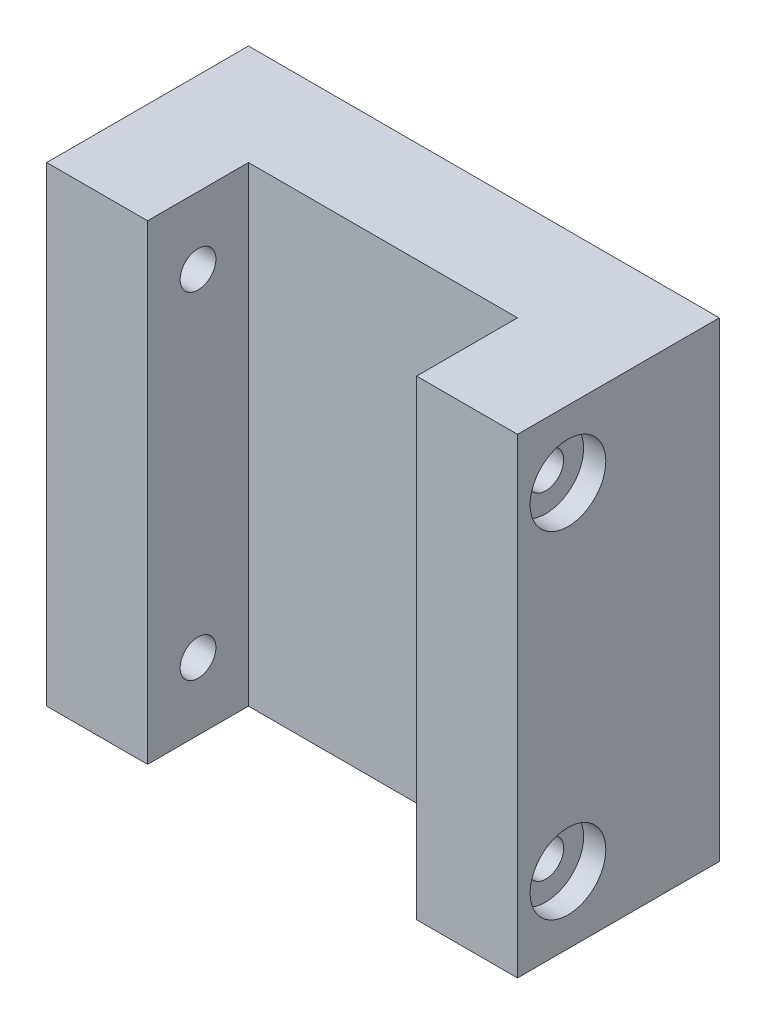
SolidWorks part; units mm, degrees
ref_plane "Front" through (0, 0, 0) normal (0, 0, 1) x (1, 0, 0)
ref_plane "Top" through (0, 0, 0) normal (0, 1, 0) x (1, 0, 0)
ref_plane "Right" through (0, 0, 0) normal (1, 0, 0) x (0, 0, -1)
sketch "Sketch1" plane through (0, 0, 0) normal (0, 0, 1) x (1, 0, 0)
  line L0 (-44.45, -44.45) -> (44.45, 44.45) construction
  line L1 (-44.45, -44.45) -> (44.45, -44.45)
  line L2 (-44.45, -44.45) -> (-44.45, 44.45)
  line L3 (-44.45, 44.45) -> (44.45, 44.45)
  line L4 (44.45, -44.45) -> (44.45, 44.45)
  dimension "D1" = 88.9
extrude "Extrude1" add sketch "Sketch1" along normal blind 38.1
sketch "Sketch2" plane through (0, 0, 0) normal (0, 0, -1) x (-1, 0, 0)
  line L0 (-44.45, -44.45) -> (44.45, 44.45) construction
  circle A0 centre (0, 0) radius 25.3619
  dimension "D1" = 50.7238
extrude "Extrude2" add sketch "Sketch2" along normal blind 13.4874
sketch "Sketch3" plane through (0, 0, 38.1) normal (0, 0, 1) x (1, 0, 0)
  line L0 (0, 44.45) -> (0, -44.45) construction
  line L1 (44.45, 44.45) -> (-44.45, 44.45) construction
  line L2 (-44.45, -44.45) -> (44.45, -44.45) construction
  line L4 (-25.4, 44.45) -> (25.4, 44.45)
  line L5 (-25.4, 44.45) -> (-25.4, -44.45)
  line L6 (-25.4, -44.45) -> (25.4, -44.45)
  line L7 (25.4, 44.45) -> (25.4, -44.45)
  dimension "D1" = 50.8
extrude "Cut-Extrude1" cut sketch "Sketch3" against normal blind 19.05
hole_wizard "CBORE for 1/4 Binding Head Machine Screw1" positions "Sketch5" profile "Sketch4" counterbore size "1/4" standard "Ansi Inch"
sketch "Sketch5" plane through (-44.45, 0, 0) normal (-1, 0, 0) x (0, 0, 1)
  line L0 (38.1, 44.45) -> (0, 44.45) construction
  line L1 (38.1, 44.45) -> (38.1, -44.45) construction
  line L2 (38.1, -44.45) -> (0, -44.45) construction
  point P0 (28.575, 31.75)
  point P1 (28.575, -31.75)
  dimension "D1" = 12.7
  dimension "D2" = 9.525
  dimension "D3" = 12.7
  dimension "D4" = 9.525
sketch "Sketch4" plane through (-44.45, 31.75, 28.575) normal (0, 1, 0) x (0, 0, 1)
  line L0 (0, 0) -> (0, 88.9)
  line L1 (0, 88.9) -> (3.3782, 88.9)
  line L3 (3.3782, 88.9) -> (3.3782, 4.191)
  line L4 (3.3782, 4.191) -> (7.1437, 4.191)
  line L5 (7.1437, 4.191) -> (7.1437, 0)
  line L7 (7.1437, 0) -> (0, 0)
  line L11 (0, -6.35) -> (0, 107.95) construction
  dimension "Thru Hole Dia." = 6.7564
  dimension "Thru Hole Depth" = 88.9
  dimension "C'Bore Dia." = 14.2875
  dimension "C'Bore Depth" = 4.191
mirror "Mirror1" about plane through (0, 0, 0) normal (1, 0, 0) of "CBORE for 1/4 Binding Head Machine Screw1"
